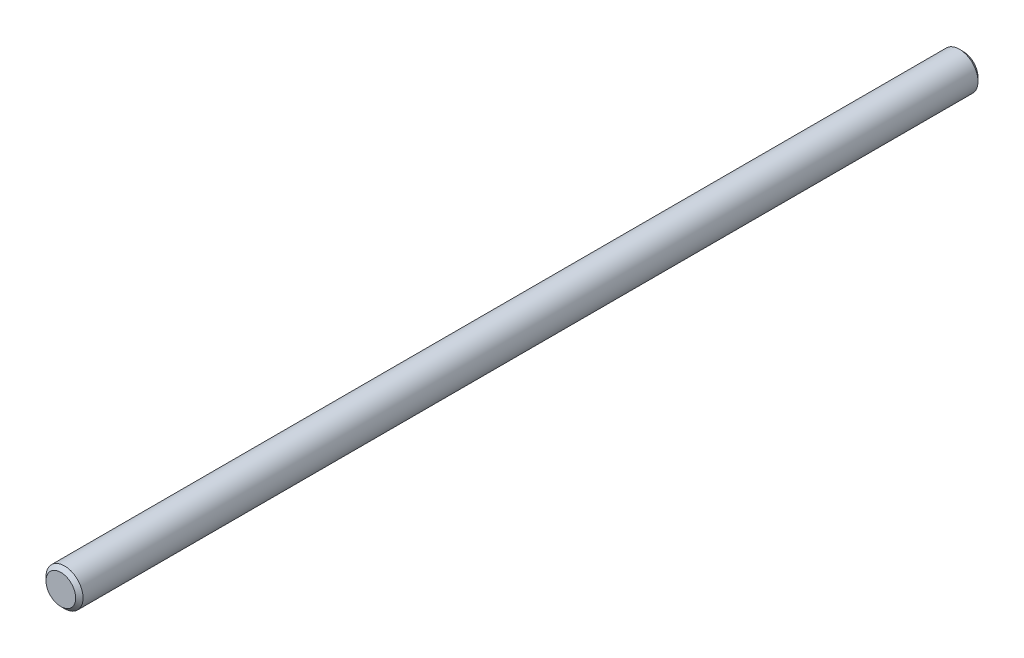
SolidWorks part; units mm, degrees
ref_plane "Plan de face" through (0, 0, 0) normal (0, 0, 1) x (1, 0, 0)
ref_plane "Plan de dessus" through (0, 0, 0) normal (0, 1, 0) x (1, 0, 0)
ref_plane "Plan de droite" through (0, 0, 0) normal (1, 0, 0) x (0, 0, -1)
sketch "Esquisse1" plane through (0, 0, 0) normal (0, 0, 1) x (1, 0, 0)
  circle A0 centre (0, 0) radius 1.5
extrude "Extrusion1" add sketch "Esquisse1" along normal blind 73
chamfer "Chanfrein1" distance 0.3 angle 45 2 edges at (1.5, 0, 0) (1.5, 0, 73)
